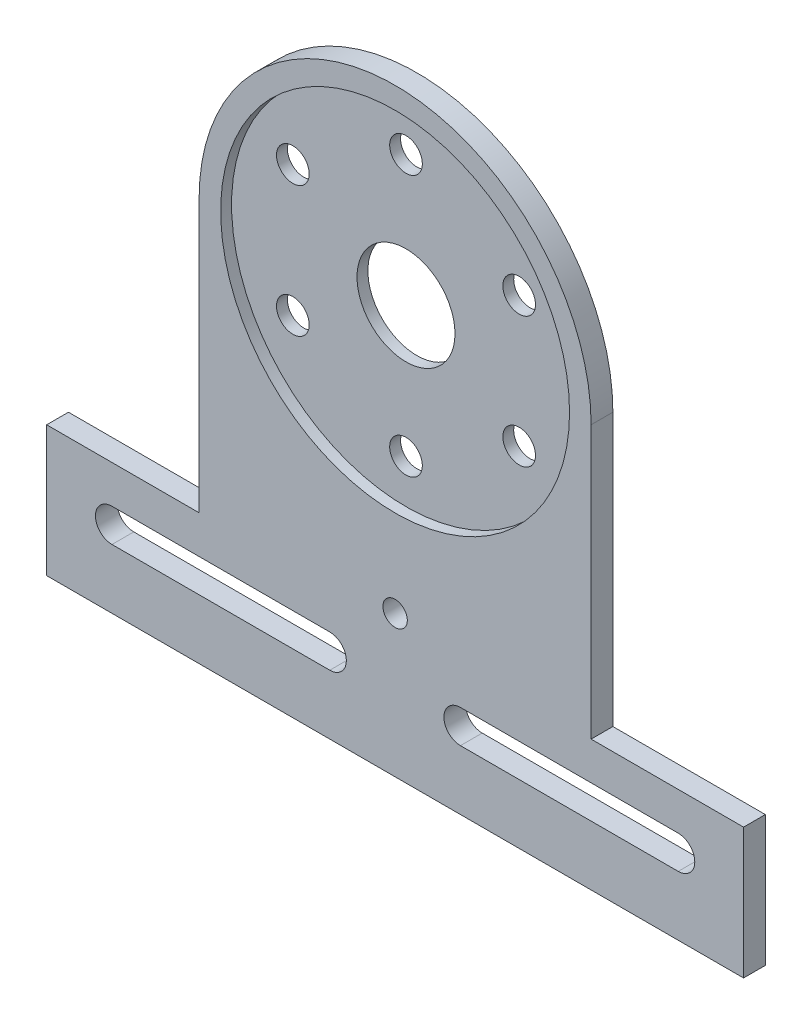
SolidWorks part; units mm, degrees
ref_plane "Front Plane" through (0, 0, 0) normal (0, 0, 1) x (1, 0, 0)
ref_plane "Top Plane" through (0, 0, 0) normal (0, 1, 0) x (1, 0, 0)
ref_plane "Right Plane" through (0, 0, 0) normal (1, 0, 0) x (0, 0, -1)
sketch "Sketch1" plane through (0, 0, 0) normal (0, 0, 1) x (1, 0, 0)
  line L1 (57.15, 0) -> (57.15, -79.375)
  line L2 (57.15, -79.375) -> (101.6, -79.375)
  line L3 (101.6, -79.375) -> (101.6, -117.475)
  line L4 (101.6, -117.475) -> (-101.6, -117.475)
  line L5 (-101.6, -117.475) -> (-101.6, -79.375)
  line L6 (-101.6, -79.375) -> (-57.15, -79.375)
  line L7 (-57.15, -79.375) -> (-57.15, 0)
  arc A0 (-57.15, 0) -> (57.15, 0) centre (0, 0) cw
  circle A1 centre (0, 0) radius 14.2875
  dimension "D1" = 57.15
  dimension "D6" = 28.575
  dimension "D2" = 203.2
  dimension "D3" = 117.475
  dimension "D4" = 101.6
  dimension "D5" = 38.1
extrude "Extrude1" add sketch "Sketch1" along normal blind 6.35
sketch "Sketch2" plane through (0, 0, 6.35) normal (0, 0, 1) x (1, 0, 0)
  circle A0 centre (0, 0) radius 50.8635
  dimension "D1" = 101.727
extrude "Cut-Extrude1" cut sketch "Sketch2" against normal blind 3.175
sketch "Sketch3" plane through (0, 0, 3.175) normal (0, 0, 1) x (1, 0, 0)
  circle A0 centre (0, 38.1) radius 4.7625
  dimension "D1" = 9.525
  dimension "D2" = 38.1
extrude "Cut-Extrude2" cut sketch "Sketch3" against normal through all
pattern_circular "CirPattern1" count 6 over 360 about axis through (0, 0, 0) along (0, 0, 1) of "Cut-Extrude2"
sketch "Sketch4" plane through (0, 0, 6.35) normal (0, 0, 1) x (1, 0, 0)
  line L0 (-101.6, -117.475) -> (101.6, -117.475) construction
  line L1 (-82.55, -100.076) -> (-19.05, -100.076)
  line L2 (-19.05, -90.424) -> (-82.55, -90.424)
  line L3 (0, 63.4541) -> (0, -166.0452) construction
  arc A0 (-82.55, -90.424) -> (-82.55, -100.076) centre (-82.55, -95.25) ccw
  arc A1 (-19.05, -100.076) -> (-19.05, -90.424) centre (-19.05, -95.25) ccw
  dimension "D1" = 4.826
  dimension "D2" = 63.5
  dimension "D3" = 22.225
  dimension "D4" = 19.05
extrude "Cut-Extrude3" cut sketch "Sketch4" against normal through all
mirror "Mirror1" about plane through (0, 0, 0) normal (1, 0, 0) of "Cut-Extrude3"
sketch "Sketch5" plane through (0, 0, 0) normal (0, 0, -1) x (-1, 0, 0)
  circle A0 centre (0, -76.2) radius 3.556
  dimension "D1" = 7.112
  dimension "D2" = 76.2
extrude "Cut-Extrude4" cut sketch "Sketch5" against normal through all
